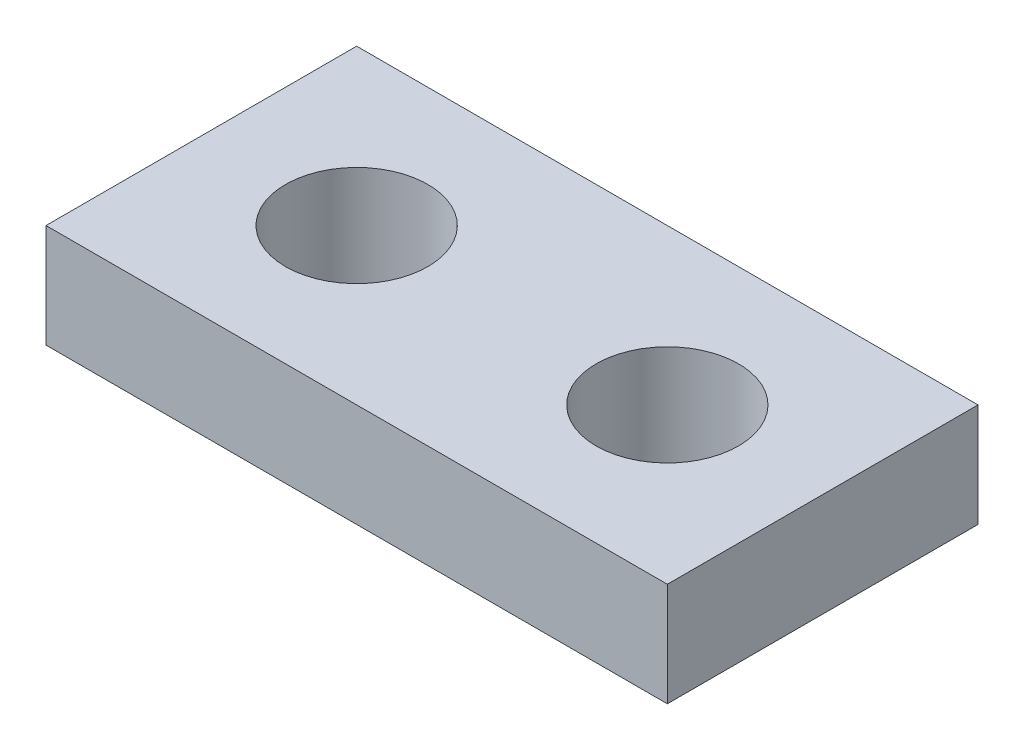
SolidWorks part; units mm, degrees
ref_plane "Front Plane" through (0, 0, 0) normal (0, 0, 1) x (1, 0, 0)
ref_plane "Top Plane" through (0, 0, 0) normal (0, 1, 0) x (1, 0, 0)
ref_plane "Right Plane" through (0, 0, 0) normal (1, 0, 0) x (0, 0, -1)
sketch "Sketch1" plane through (0, 0, 0) normal (0, 1, 0) x (1, 0, 0)
  line L0 (-38.1, 0) -> (38.1, 0) construction
  line L1 (-38.1, -19.05) -> (38.1, -19.05)
  line L2 (-38.1, -19.05) -> (-38.1, 19.05)
  line L3 (-38.1, 19.05) -> (38.1, 19.05)
  line L4 (38.1, -19.05) -> (38.1, 19.05)
  line L5 (-38.1, -19.05) -> (38.1, 19.05) construction
  line L6 (-38.1, 19.05) -> (38.1, -19.05) construction
  line L7 (-19.05, 19.05) -> (-19.05, -19.05) construction
  line L8 (19.05, 19.05) -> (19.05, -19.05) construction
  point P0 (0, 0)
  point P12 (-19.05, 0)
  point P13 (19.05, 0)
  dimension "D1" = 76.2
  dimension "D2" = 38.1
  dimension "D3" = 19.05
  dimension "D4" = 19.05
extrude "Boss-Extrude1" add sketch "Sketch1" against normal blind 12.7
sketch "Sketch2" plane through (0, 0, 0) normal (0, 1, 0) x (1, 0, 0)
  circle A0 centre (-19.05, 0) radius 8.7312
  circle A1 centre (-19.05, 0) radius 9.525 construction
  dimension "D1" = 17.4625
  dimension "D2" = 19.05
extrude "Cut-Extrude1" cut sketch "Sketch2" against normal through all
hole_wizard "3/4-16 Tapped Hole1" positions "Sketch3" profile "Sketch4" tap size "3/4-16" standard "ANSI Inch"
sketch "Sketch3" plane through (0, 0, 0) normal (0, 1, 0) x (1, 0, 0)
  point P0 (19.05, 0)
sketch "Sketch4" plane through (19.05, 0, 0) normal (1, 0, 0) x (0, 0, 1)
  line L0 (0, 0) -> (0, 12.7)
  line L1 (0, 12.7) -> (8.7312, 12.7)
  line L2 (8.7312, 12.7) -> (8.7312, 0)
  line L5 (8.7312, 0) -> (0, 0)
  line L11 (0, -6.35) -> (0, 107.95) construction
  dimension "Thru Tap Drill Dia." = 17.4625
  dimension "Thru Tap Drill Depth" = 12.7
